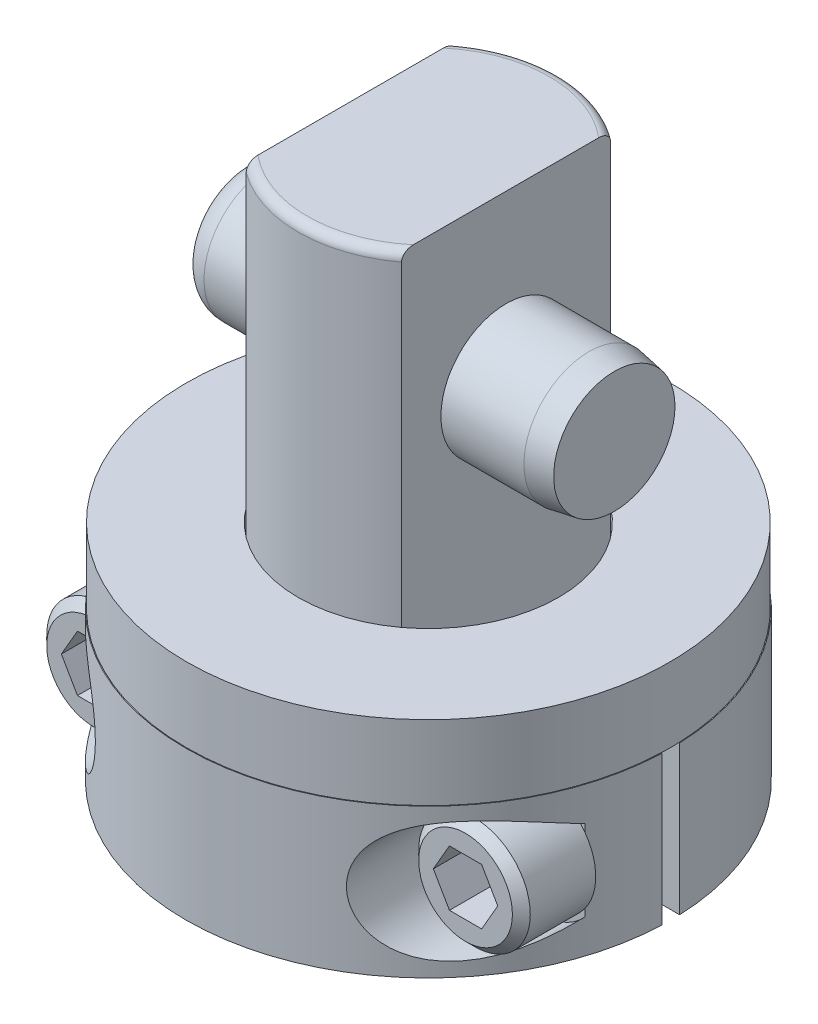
SolidWorks part; units mm, degrees
ref_plane "Front Plane" through (0, 0, 0) normal (0, 0, 1) x (1, 0, 0)
ref_plane "Top Plane" through (0, 0, 0) normal (0, 1, 0) x (1, 0, 0)
ref_plane "Right Plane" through (0, 0, 0) normal (1, 0, 0) x (0, 0, -1)
sketch "Sketch1" plane through (0, 0, 0) normal (1, 0, 0) x (0, 0, -1)
  line L0 (0, 40.4876) -> (11.1125, 40.4876)
  line L1 (11.1125, 40.4876) -> (11.1125, 0)
  line L2 (11.1125, 0) -> (6.35, 0)
  line L3 (6.35, 0) -> (6.35, -12.7)
  line L4 (6.35, -12.7) -> (0, -12.7)
  line L5 (0, -12.7) -> (0, 40.4876)
  line L6 (0, -15.3594) -> (0, 43.147) construction
  dimension "D1" = 53.1876
  dimension "D2" = 12.7
  dimension "D3" = 12.7
  dimension "D4" = 22.225
revolve "Revolve1" add sketch "Sketch1" angle 360 about L6
fillet "Fillet1" radius 0.7874 1 edges at (0, 40.4876, -11.1125)
sketch "Sketch2" plane through (0, 0, 0) normal (0, 0, 1) x (1, 0, 0)
  line L0 (6.6294, 40.4876) -> (11.1125, 40.4876)
  line L1 (11.1125, 40.4876) -> (11.1125, 7.62)
  line L2 (11.1125, 7.62) -> (6.6294, 7.62)
  line L3 (6.6294, 7.62) -> (6.6294, 40.4876)
  line L4 (-11.1125, 40.4876) -> (-6.6294, 40.4876)
  line L5 (-6.6294, 40.4876) -> (-6.6294, 7.62)
  line L6 (-6.6294, 7.62) -> (-11.1125, 7.62)
  line L7 (-11.1125, 7.62) -> (-11.1125, 40.4876)
  line L8 (0, 5.9766) -> (0, 42.131) construction
  line L9 (10.3251, 40.4876) -> (-10.3251, 40.4876) construction
  line L10 (11.1125, 0) -> (11.1125, 39.7002) construction
  line L11 (-11.1125, 39.7002) -> (-11.1125, 0) construction
  dimension "D1" = 13.2588
  dimension "D2" = 32.8676
extrude "Cut-Extrude1" cut sketch "Sketch2" against normal through all and the other way through all
sketch "Sketch3" plane through (0, 0, 0) normal (0, -1, 0) x (1, 0, 0)
  circle A0 centre (0, 0) radius 5.588
  circle A1 centre (0, 0) radius 6.35 construction
  circle A2 centre (0, 0) radius 6.35
  dimension "D1" = 11.176
extrude "Cut-Extrude2" cut sketch "Sketch3" along normal blind 2.54
chamfer "Chamfer1" distance 0.762 angle 45 1 edges at (0, -12.7, -6.35)
sketch "Sketch4" plane through (0, 0, 0) normal (1, 0, 0) x (0, 0, -1)
  line L0 (-11.1125, 0) -> (11.1125, 0) construction
  circle A0 centre (0, 26.6192) radius 5.5588
  dimension "D1" = 11.1176
  dimension "D2" = 26.6192
extrude "Extrude1" add sketch "Sketch4" along normal mid plane 31.75
chamfer "Chamfer2" distance 0.381 angle 80 1 edges at (15.875, 26.6192, -5.5588)
fillet "Fillet2" radius 2.286 1 edges at (-15.875, 26.6192, -5.5588)
sketch "Sketch5" plane through (0, 0, 0) normal (0, 1, 0) x (1, 0, 0)
  line L0 (11.0863, 0.762) -> (20.687, 0.762)
  line L1 (11.0863, -0.762) -> (20.687, -0.762)
  line L2 (-11.0863, -0.762) -> (-20.687, -0.762)
  line L3 (-11.0863, 0.762) -> (-20.687, 0.762)
  line L4 (0, 0) -> (24.3028, 0) construction
  arc A0 (20.687, 0.762) -> (-20.687, 0.762) centre (0, 0) ccw
  arc A1 (-20.687, -0.762) -> (20.687, -0.762) centre (0, 0) ccw
  arc A2 (11.0863, 0.762) -> (-11.0863, 0.762) centre (0, 0) ccw
  arc A3 (-11.0863, -0.762) -> (11.0863, -0.762) centre (0, 0) ccw
  circle A4 centre (0, 0) radius 11.1125 construction
  dimension "D2" = 20.701
  dimension "D1" = 1.524
extrude "Extrude2" add sketch "Sketch5" along normal blind 6.35 and the other way blind 6.35
sketch "Sketch6" plane through (0, 0, 0.762) normal (0, 0, 1) x (1, 0, 0)
  line L0 (0, -5.6718) -> (0, 5.6718) construction
  line L1 (-20.687, -6.35) -> (20.687, -6.35) construction
  circle A0 centre (15.875, 0) radius 5.1562
  circle A1 centre (-15.875, 0) radius 5.1562
  dimension "D1" = 10.3124
  dimension "D2" = 31.75
  dimension "D3" = 6.35
extrude "Cut-Extrude3" cut sketch "Sketch6" along normal through all from offset 5.588
sketch "Sketch7" plane through (0, 0, 6.35) normal (0, 0, 1) x (1, 0, 0)
  circle A0 centre (15.875, 0) radius 4.7625
  circle A1 centre (-15.875, 0) radius 4.7625
  arc A3 (-19.703, -3.4544) -> (-19.703, 3.4544) centre (-15.875, 0) ccw construction
  arc A4 (19.703, 3.4544) -> (19.703, -3.4544) centre (15.875, 0) ccw construction
  dimension "D1" = 9.525
extrude "Extrude3" add sketch "Sketch7" along normal blind 6.35
chamfer "Chamfer3" distance 0.762 angle 45 2 edges at (-11.1125, 0, 12.7) (20.6375, 0, 12.7)
sketch "Sketch8" plane through (0, 0, 12.7) normal (0, 0, 1) x (1, 0, 0)
  line L0 (0, 0) -> (0, -21.769) construction
  line L1 (17.2498, 2.3813) -> (18.6246, 0)
  line L2 (14.5002, 2.3813) -> (17.2498, 2.3813)
  line L3 (13.1254, 0) -> (14.5002, 2.3813)
  line L4 (14.5002, -2.3812) -> (13.1254, 0)
  line L5 (17.2498, -2.3812) -> (14.5002, -2.3812)
  line L6 (18.6246, 0) -> (17.2498, -2.3812)
  line L8 (-18.6246, 0) -> (-17.2498, -2.3813)
  line L9 (-17.2498, -2.3813) -> (-14.5002, -2.3813)
  line L10 (-14.5002, -2.3813) -> (-13.1254, 0)
  line L11 (-13.1254, 0) -> (-14.5002, 2.3812)
  line L12 (-14.5002, 2.3812) -> (-17.2498, 2.3812)
  line L13 (-17.2498, 2.3812) -> (-18.6246, 0)
  circle A0 centre (-15.875, 0) radius 2.3813 construction
  circle A1 centre (15.875, 0) radius 2.3813 construction
  dimension "D2" = 4.7625
extrude "Cut-Extrude4" cut sketch "Sketch8" against normal blind 4.7625
sketch "Sketch10" plane through (0, 0, 0) normal (0, 0, 1) x (1, 0, 0)
  circle A0 centre (15.875, 0) radius 3.175
  circle A1 centre (-15.875, 0) radius 3.175
  circle A2 centre (-15.875, 0) radius 4.7625 construction
  circle A3 centre (15.875, 0) radius 4.7625 construction
  dimension "D1" = 6.35
extrude "Extrude4" add sketch "Sketch10" along normal up to next and the other way up to next
sketch "Sketch11" plane through (0, 6.35, 0) normal (0, 1, 0) x (-1, 0, 0)
  circle A0 centre (0, 0) radius 20.6375
  circle A1 centre (0, 0) radius 11.1125
  circle A3 centre (0, 0) radius 6.35 construction
  dimension "D1" = 41.275
  dimension "D2" = 22.225
extrude "Extrude5" add sketch "Sketch11" along normal blind 6.35
